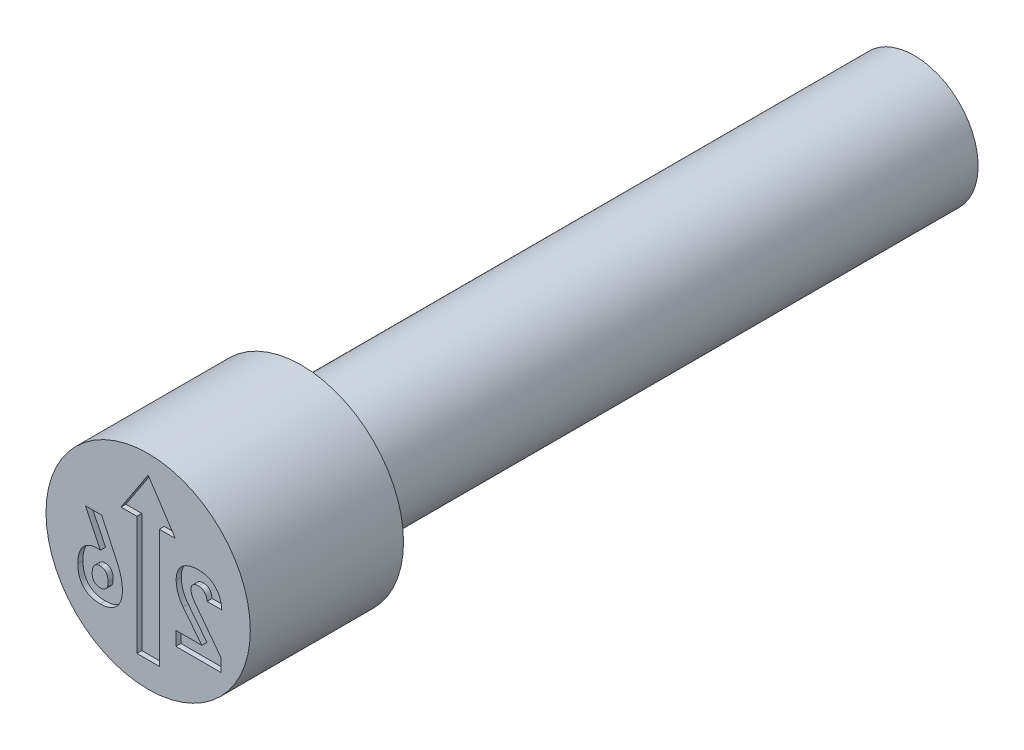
SolidWorks part; units mm, degrees
ref_plane "Front Plane" through (0, 0, 0) normal (0, 0, 1) x (1, 0, 0)
ref_plane "Top Plane" through (0, 0, 0) normal (0, 1, 0) x (1, 0, 0)
ref_plane "Right Plane" through (0, 0, 0) normal (1, 0, 0) x (0, 0, -1)
imported_body "Imported1"
sketch "Sketch1" plane through (0, 0, -0.3556) normal (0, 0, 1) x (1, 0, 0)
  line L7 (0.5321, 0.8255) -> (0, 1.6331)
  line L8 (0, 1.6331) -> (-0.5321, 0.8255)
  line L9 (-0.5321, 0.8255) -> (-0.22, 0.8255)
  line L10 (-0.22, 0.8255) -> (-0.22, -1.5)
  line L11 (-0.22, -1.5) -> (0.22, -1.5)
  line L12 (0.22, -1.5) -> (0.22, 0.8255)
  line L13 (0.22, 0.8255) -> (0.5321, 0.8255)
  line L14 (0.5321, 0.8255) -> (0, 1.6331)
  line L15 (0, 1.6331) -> (-0.5321, 0.8255)
  line L16 (-0.5321, 0.8255) -> (-0.22, 0.8255)
  line L17 (-0.22, 0.8255) -> (-0.22, -1.5)
  line L18 (-0.22, -1.5) -> (0.22, -1.5)
  line L19 (0.22, -1.5) -> (0.22, 0.8255)
  line L20 (0.22, 0.8255) -> (0.5321, 0.8255)
  dimension "D1" = 0
extrude "Boss-Extrude1" add sketch "Sketch1" along normal blind 0.26
sketch "Sketch2" plane through (0, 0, 0) normal (0, 0, 1) x (1, 0, 0)
  text T0 "2  6" font "Bahnschrift" height 1.5
  dimension "D2" = 1
extrude "Cut-Extrude1" cut sketch "Sketch2" against normal blind 0.1
